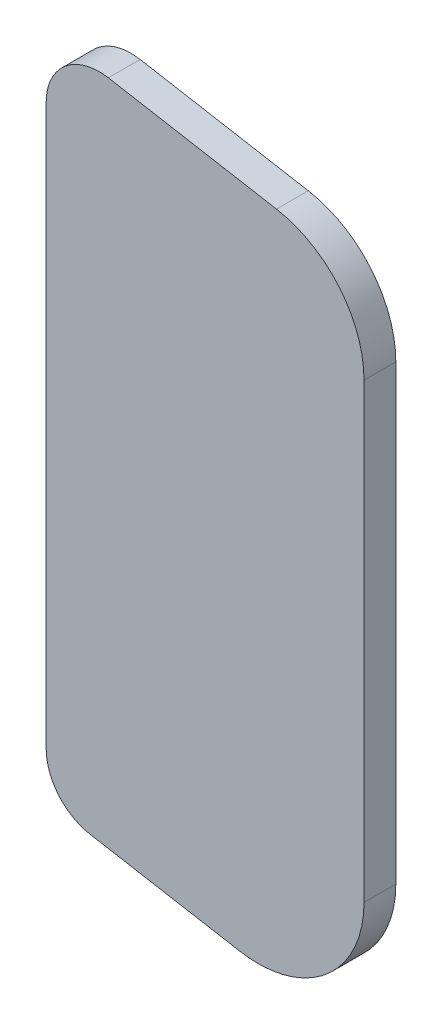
SolidWorks part; units mm, degrees
ref_plane "Face" through (0, 0, 0) normal (0, 0, 1) x (1, 0, 0)
ref_plane "Dessus" through (0, 0, 0) normal (0, 1, 0) x (1, 0, 0)
ref_plane "Droite" through (0, 0, 0) normal (1, 0, 0) x (0, 0, -1)
sketch "Esquisse1" plane through (0, 0, 0) normal (0, 0, 1) x (1, 0, 0)
  line L0 (-10.7817, 17.2702) -> (5.0866, 14.4722)
  line L1 (13.3501, 4.6242) -> (13.3501, -38.0673)
  line L2 (1.6136, -47.9154) -> (-12.5182, -45.4236)
  line L3 (-16.6499, -40.4995) -> (-16.6499, 12.3462)
  line L4 (-16.6499, 18.305) -> (0, 18.305) construction
  arc A0 (-16.6499, 12.3462) -> (-10.7817, 17.2702) centre (-11.6499, 12.3462) cw
  arc A1 (1.6136, -47.9154) -> (13.3501, -38.0673) centre (3.3501, -38.0673) ccw
  arc A2 (5.0866, 14.4722) -> (13.3501, 4.6242) centre (3.3501, 4.6242) cw
  arc A3 (-12.5182, -45.4236) -> (-16.6499, -40.4995) centre (-11.6499, -40.4995) cw
  point P14 (-16.6499, -44.695)
  dimension "D4" = 5
  dimension "D5" = 10
  dimension "D6" = 10
  dimension "D7" = 5
  dimension "D1" = 30
  dimension "D2" = 63
  dimension "D3" = 10
extrude "Extrusion1" add sketch "Esquisse1" along normal blind 3
